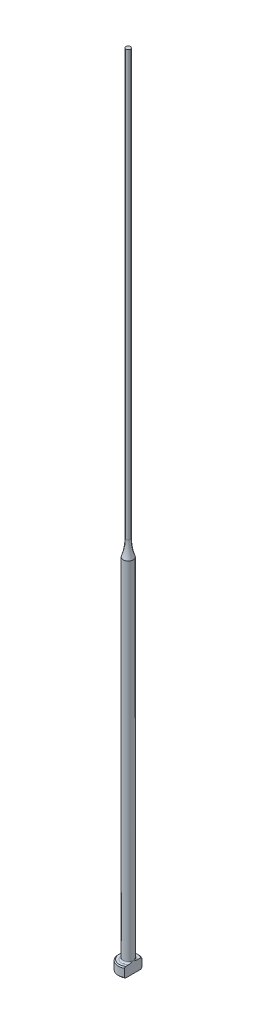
SolidWorks part; units mm, degrees
ref_plane "Front Plane" through (0, 0, 0) normal (0, 0, 1) x (1, 0, 0)
ref_plane "Top Plane" through (0, 0, 0) normal (0, 1, 0) x (1, 0, 0)
ref_plane "Right Plane" through (0, 0, 0) normal (1, 0, 0) x (0, 0, -1)
sketch "Sketch1" plane through (0, 0, 0) normal (0, 0, 1) x (1, 0, 0)
  line L0 (0, 259.9588) -> (0, -15.1925) construction
  line L1 (0, 0) -> (-2, 0)
  line L2 (-2, 0) -> (-2, 2)
  line L3 (-2, 2) -> (-1, 2)
  line L4 (-0.45, 75) -> (-0.45, 160)
  line L5 (-0.45, 160) -> (0, 160)
  line L6 (0, 160) -> (0, 0)
  line L7 (-1, 2) -> (-1, 71.7293)
  arc A0 (-1, 71.7293) -> (-0.45, 75) centre (-10.45, 75) ccw
  point P13 (-1, 0)
  dimension "D1" = 10
  dimension "L" = 160
  dimension "H" = 4
  dimension "T" = 2
  dimension "D" = 0.9
  dimension "B" = 2
  dimension "S" = 75
revolve "Revolve1" add sketch "Sketch1" angle 360 about L0
chamfer "Chamfer1" distance 0.2 angle 45 2 edges at (0, 2, 2) (0, 0, 2)
fillet "Fillet1" radius 0.3 1 edges at (0, 2, 1)
sketch "Sketch2" plane through (0, 0, 0) normal (0, 1, 0) x (1, 0, 0)
  line L0 (1, 1.7321) -> (1, -1.7321)
  circle A0 centre (0, 0) radius 2 construction
  arc A1 (1, -1.7321) -> (1, 1.7321) centre (0, 0) ccw
  circle A2 centre (0, 0) radius 1 construction
extrude "KEY" cut sketch "Sketch2" along normal through all
